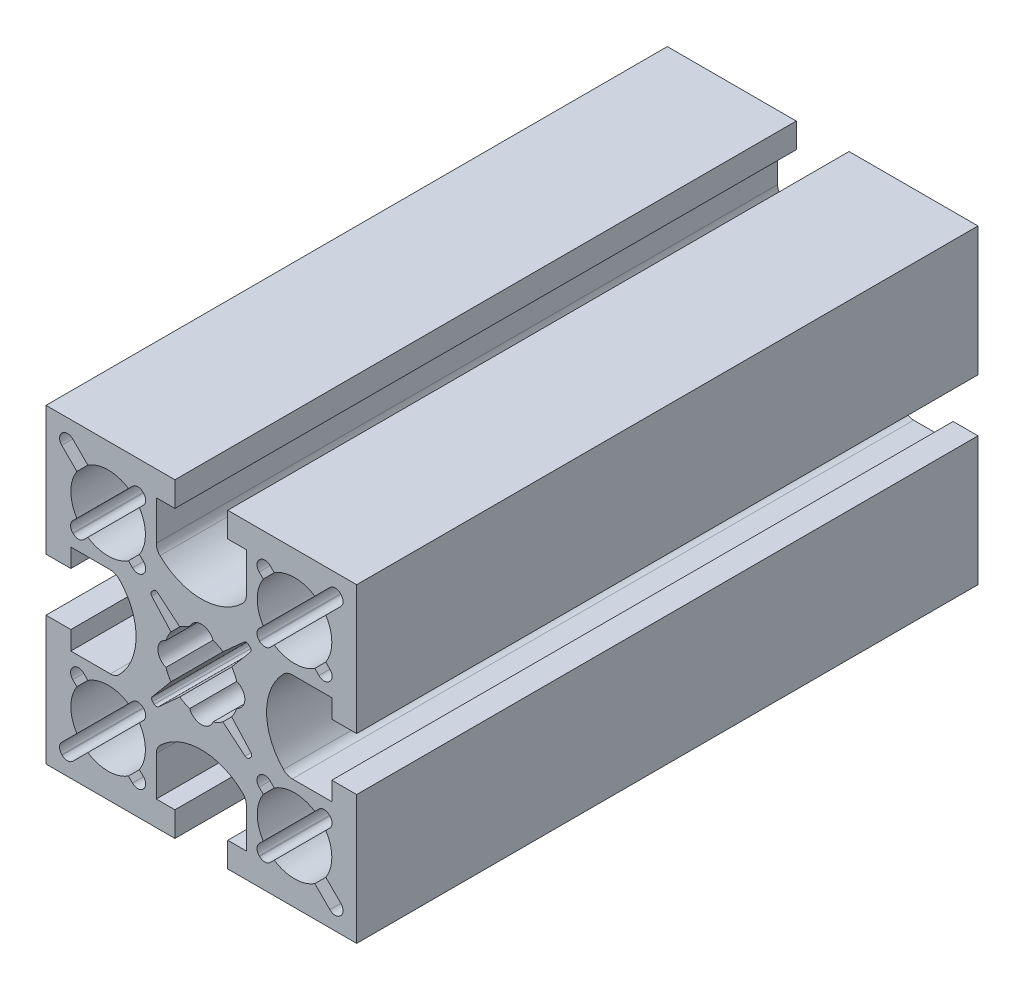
SolidWorks part; units mm, degrees
ref_plane "前基準面" through (0, 0, 0) normal (0, 0, 1) x (1, 0, 0)
ref_plane "上基準面" through (0, 0, 0) normal (0, 1, 0) x (1, 0, 0)
ref_plane "右基準面" through (0, 0, 0) normal (1, 0, 0) x (0, 0, -1)
sketch "草圖1" plane through (0, 0, 0) normal (0, 0, 1) x (1, 0, 0)
  line L0 (0, 53.2301) -> (0, -51.0629) construction
  line L2 (-25, 25) -> (25, 25)
  line L3 (-25, 25) -> (-25, -25)
  line L4 (-25, -25) -> (25, -25)
  line L5 (25, 25) -> (25, -25)
  line L6 (-25, 25) -> (25, -25) construction
  line L7 (-25, -25) -> (25, 25) construction
  point P3 (0, 0)
  dimension "D1" = 50
  dimension "D2" = 50
extrude "填料-伸長1" add sketch "草圖1" along normal mid plane 100
sketch "草圖10" plane through (0, 0, 50) normal (0, 0, 1) x (1, 0, 0)
  circle A0 centre (0, 0) radius 6
  dimension "D1" = 12
extrude "除料-伸長8" cut sketch "草圖10" against normal through all
sketch "草圖11" plane through (0, 0, 50) normal (0, 0, 1) x (1, 0, 0)
  line L0 (0, 0) -> (8.3122, 8.3122) construction
  line L1 (0, 0) -> (6, 0) construction
  line L2 (7.876, 7.0343) -> (4.8904, 3.4762)
  line L3 (6.9045, 7.9772) -> (3.4762, 4.8904)
  line L4 (7.9772, -6.9045) -> (4.8904, -3.4762)
  line L5 (7.0343, -7.876) -> (3.4762, -4.8904)
  line L6 (-6.9045, -7.9772) -> (-3.4762, -4.8904)
  line L7 (-7.876, -7.0343) -> (-4.8904, -3.4762)
  line L8 (-7.9772, 6.9045) -> (-4.8904, 3.4762)
  line L9 (-7.0343, 7.876) -> (-3.4762, 4.8904)
  circle A0 centre (0, 0) radius 6 construction
  arc A1 (3.4762, 4.8904) -> (-3.4762, 4.8904) centre (0, 0) ccw
  arc A2 (7.876, 7.0343) -> (7.8498, 7.7059) centre (7.493, 7.3557) ccw
  circle A3 centre (0, 0) radius 11
  arc A4 (7.8498, 7.7059) -> (7.5838, 7.9678) centre (0, 0) ccw
  arc A5 (6.9045, 7.9772) -> (7.5838, 7.9678) centre (7.239, 7.6057) cw
  arc A6 (7.9772, -6.9045) -> (7.9678, -7.5838) centre (7.6057, -7.239) cw
  arc A7 (7.7059, -7.8498) -> (7.9678, -7.5838) centre (0, 0) ccw
  arc A8 (7.0343, -7.876) -> (7.7059, -7.8498) centre (7.3557, -7.493) ccw
  arc A9 (-6.9045, -7.9772) -> (-7.5838, -7.9678) centre (-7.239, -7.6057) cw
  arc A10 (-7.8498, -7.7059) -> (-7.5838, -7.9678) centre (0, 0) ccw
  arc A11 (-7.876, -7.0343) -> (-7.8498, -7.7059) centre (-7.493, -7.3557) ccw
  arc A12 (-7.9772, 6.9045) -> (-7.9678, 7.5838) centre (-7.6057, 7.239) cw
  arc A13 (-7.7059, 7.8498) -> (-7.9678, 7.5838) centre (0, 0) ccw
  arc A14 (-7.0343, 7.876) -> (-7.7059, 7.8498) centre (-7.3557, 7.493) ccw
  arc A15 (4.8904, -3.4762) -> (4.8904, 3.4762) centre (0, 0) ccw
  arc A16 (-3.4762, -4.8904) -> (3.4762, -4.8904) centre (0, 0) ccw
  arc A17 (-4.8904, 3.4762) -> (-4.8904, -3.4762) centre (0, 0) ccw
  point P40 (0, 0)
  dimension "D5" = 0.5
  dimension "D6" = 4
  dimension "D1" = 45
  dimension "D2" = 8
  dimension "D3" = 2
  dimension "D4" = 5
extrude "除料-伸長9" cut sketch "草圖11" against normal through all
sketch "草圖13" plane through (0, 0, 50) normal (0, 0, 1) x (1, 0, 0)
  line L0 (0, 5) -> (0, 7) construction
  arc A0 (-1.8735, 5.7) -> (1.8735, 5.7) centre (0, 5) cw
  arc A1 (3.4762, 4.8904) -> (-3.4762, 4.8904) centre (0, 0) ccw construction
  arc A2 (1.8735, 5.7) -> (-1.8735, 5.7) centre (0, 0) ccw
  dimension "D1" = 2
  dimension "D2" = 5
extrude "除料-伸長10" cut sketch "草圖13" against normal through all
pattern_circular "環狀複製排列1" count 4 over 360 about axis through (0, 0, 0) along (0, 0, 1) of "除料-伸長10"
sketch "草圖14" plane through (0, 0, 50) normal (0, 0, 1) x (1, 0, 0)
  circle A0 centre (-15, 15) radius 6
  dimension "D3" = 12
  dimension "D1" = 15
  dimension "D2" = 15
extrude "除料-伸長11" cut sketch "草圖14" against normal through all
sketch "草圖15" plane through (0, 0, 50) normal (0, 0, 1) x (1, 0, 0)
  line L0 (-15, 15) -> (-10.7574, 19.2426) construction
  line L1 (-9.9666, 18.2657) -> (-9.3079, 18.9243)
  line L2 (-15, 21) -> (-15, 15) construction
  line L3 (-11.7343, 20.0334) -> (-11.0757, 20.6921)
  line L4 (-9.9666, 11.7343) -> (-9.3079, 11.0757)
  line L5 (-11.7343, 9.9666) -> (-11.0757, 9.3079)
  line L6 (-18.2657, 9.9666) -> (-18.9243, 9.3079)
  line L7 (-20.0334, 11.7343) -> (-20.6921, 11.0757)
  line L8 (-15, 15) -> (-9.9666, 18.2657) construction
  line L9 (-15, 15) -> (-11.7343, 9.9666) construction
  line L10 (-20.0334, 18.2657) -> (-22.4599, 20.6921)
  line L11 (-18.2657, 20.0334) -> (-20.6921, 22.4599)
  circle A0 centre (-15, 15) radius 6 construction
  arc A1 (-11.7343, 20.0334) -> (-18.2657, 20.0334) centre (-15, 15) ccw
  arc A2 (-20.0334, 18.2657) -> (-20.0334, 11.7343) centre (-15, 15) ccw
  circle A3 centre (-15, 15) radius 8
  arc A4 (-8.5287, 19.7035) -> (-10.2965, 21.4713) centre (-15, 15) ccw construction
  arc A5 (-9.3017, 20.6151) -> (-9.3849, 20.6983) centre (-15, 15) ccw
  arc A6 (-9.3079, 18.9243) -> (-9.3017, 20.6151) centre (-10.1564, 19.7728) ccw
  arc A7 (-11.0757, 20.6921) -> (-9.3849, 20.6983) centre (-10.2272, 19.8436) cw
  arc A8 (-9.3079, 11.0757) -> (-9.3017, 9.3849) centre (-10.1564, 10.2272) cw
  arc A9 (-11.0757, 9.3079) -> (-9.3849, 9.3017) centre (-10.2272, 10.1564) ccw
  arc A10 (-18.9243, 9.3079) -> (-20.6151, 9.3017) centre (-19.7728, 10.1564) cw
  arc A11 (-20.6921, 11.0757) -> (-20.6983, 9.3849) centre (-19.8436, 10.2272) ccw
  arc A12 (-9.9666, 11.7343) -> (-9.9666, 18.2657) centre (-15, 15) ccw
  arc A13 (-9.3849, 9.3017) -> (-9.3017, 9.3849) centre (-15, 15) ccw
  arc A14 (-20.6983, 9.3849) -> (-20.6151, 9.3017) centre (-15, 15) ccw
  arc A15 (-18.2657, 9.9666) -> (-11.7343, 9.9666) centre (-15, 15) ccw
  arc A16 (-22.3846, 22.4644) -> (-22.4644, 22.3846) centre (-15, 15) ccw
  arc A18 (-22.4599, 20.6921) -> (-22.4644, 22.3846) centre (-21.6114, 21.5406) cw
  arc A19 (-22.3846, 22.4644) -> (-20.6921, 22.4599) centre (-21.5406, 21.6114) cw
  arc A20 (-20.6921, 18.9243) -> (-20.6983, 20.6151) centre (-19.8436, 19.7728) cw
  arc A21 (-18.9243, 20.6921) -> (-20.6151, 20.6983) centre (-19.7728, 19.8436) ccw
  arc A22 (-20.6151, 20.6983) -> (-20.6983, 20.6151) centre (-15, 15) ccw
  point P52 (-15, 15)
  dimension "D2" = 2
  dimension "D4" = 1.2
  dimension "D9" = 1.2
  dimension "D8" = 4.5
  dimension "D10" = 10.5
  dimension "D1" = 45
  dimension "D3" = 2.5
  dimension "D6" = 90
  dimension "D5" = 4
  dimension "D7" = 4
extrude "除料-伸長12" cut sketch "草圖15" against normal through all
pattern_circular "環狀複製排列2" count 4 over 360 about axis through (0, 0, 0) along (0, 0, 1) of "除料-伸長11", "除料-伸長12"
sketch "草圖16" plane through (0, 0, 50) normal (0, 0, 1) x (1, 0, 0)
  line L0 (0, 0) -> (0, 25) construction
  line L1 (25, 25) -> (-25, 25) construction
  line L2 (-4.25, 25) -> (4.25, 25)
  line L3 (-4.25, 25) -> (-4.25, 21)
  line L4 (-4.25, 21) -> (-7.25, 21)
  line L5 (-7.25, 21) -> (-7.25, 13.861)
  line L6 (7.25, 21) -> (7.25, 13.861)
  line L7 (4.25, 21) -> (7.25, 21)
  line L8 (4.25, 25) -> (4.25, 21)
  arc A0 (-7.25, 13.861) -> (7.25, 13.861) centre (0, 20) ccw
  dimension "D5" = 9.5
  dimension "D1" = 5
  dimension "D2" = 4
  dimension "D3" = 14.5
  dimension "D4" = 8.5
extrude "除料-伸長13" cut sketch "草圖16" against normal through all
fillet "圓角2" radius 2 2 edges at (7.25, 13.861, 0) (-7.25, 13.861, 0)
pattern_circular "環狀複製排列3" count 4 over 360 about axis through (0, 0, 0) along (0, 0, 1) of "除料-伸長13", "圓角2"
